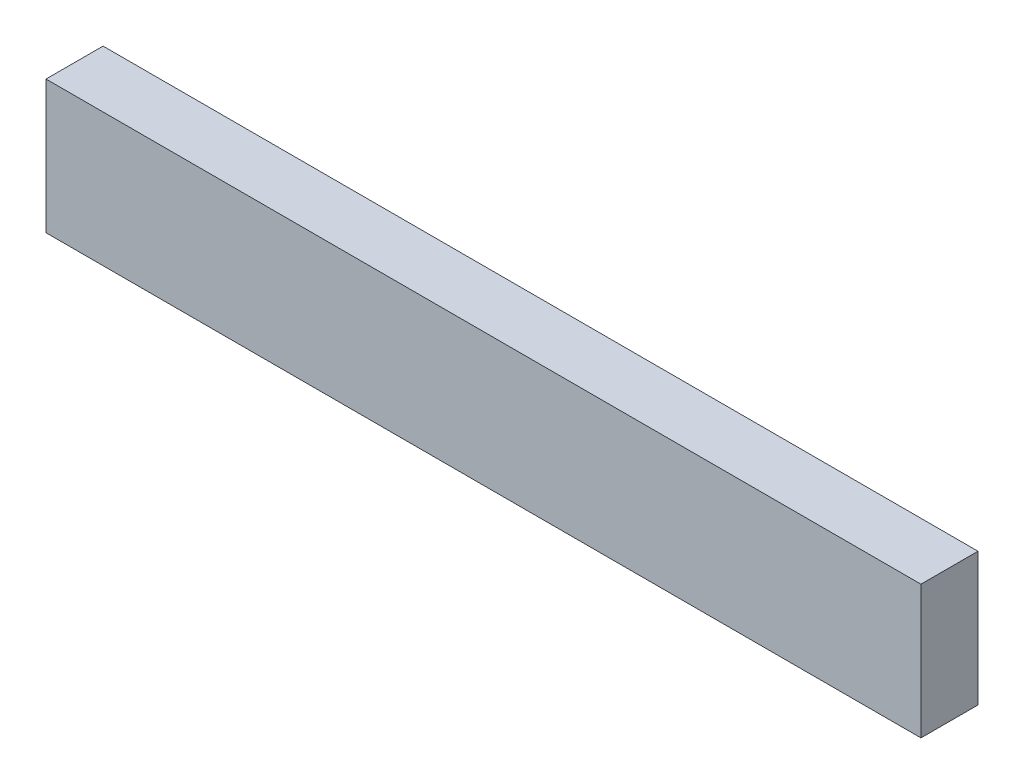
SolidWorks part; units mm, degrees
ref_plane "Front Plane" through (0, 0, 0) normal (0, 0, 1) x (1, 0, 0)
ref_plane "Top Plane" through (0, 0, 0) normal (0, 1, 0) x (1, 0, 0)
ref_plane "Right Plane" through (0, 0, 0) normal (1, 0, 0) x (0, 0, -1)
sketch "Sketch1" plane through (0, 0, 0) normal (1, 0, 0) x (0, 0, -1)
  line L1 (-19.05, -44.45) -> (19.05, -44.45)
  line L2 (-19.05, -44.45) -> (-19.05, 44.45)
  line L3 (-19.05, 44.45) -> (19.05, 44.45)
  line L4 (19.05, -44.45) -> (19.05, 44.45)
  line L5 (-19.05, -44.45) -> (19.05, 44.45) construction
  line L6 (-19.05, 44.45) -> (19.05, -44.45) construction
  point P0 (0, 0)
  dimension "D1" = 88.9
  dimension "D2" = 38.1
extrude "Boss-Extrude1" add sketch "Sketch1" along normal blind 584.2
